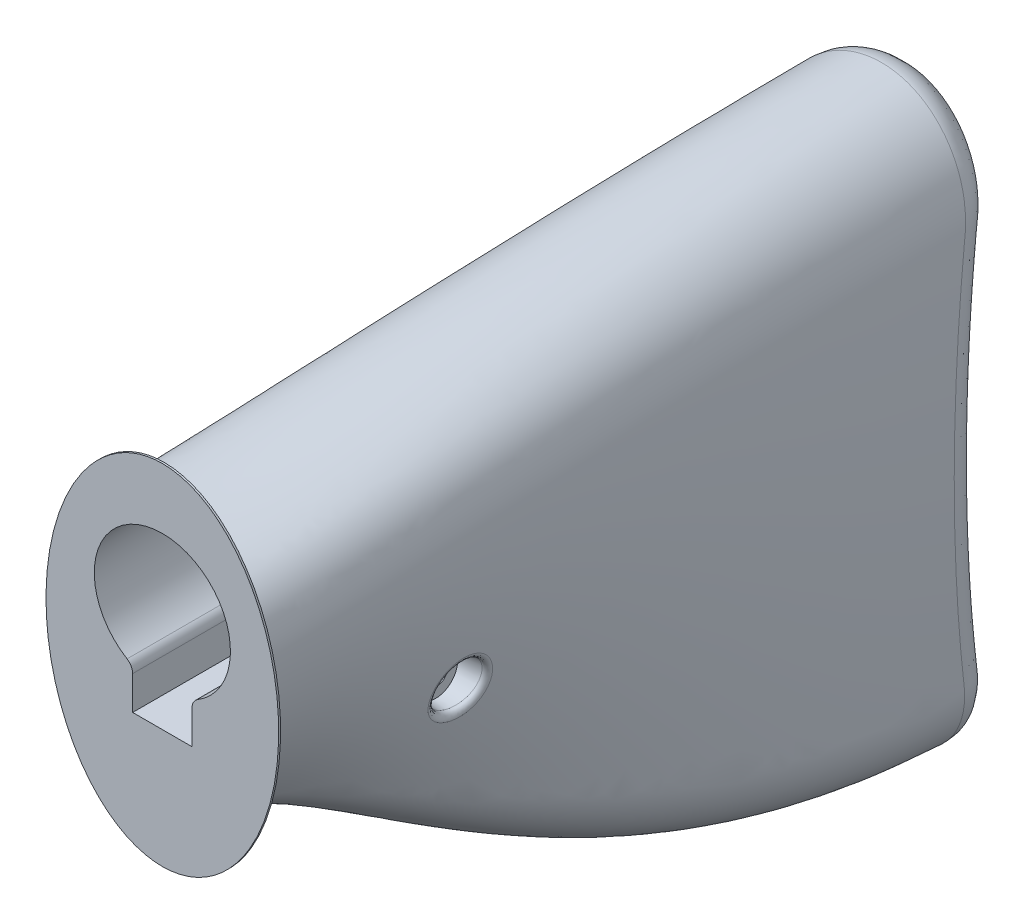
SolidWorks part; units mm, degrees
ref_plane "Front Plane" through (0, 0, 0) normal (0, 0, 1) x (1, 0, 0)
ref_plane "Top Plane" through (0, 0, 0) normal (0, 1, 0) x (1, 0, 0)
ref_plane "Right Plane" through (0, 0, 0) normal (1, 0, 0) x (0, 0, -1)
sketch "Sketch1" plane through (0, 0, 0) normal (0, 0, 1) x (1, 0, 0)
  line L0 (0, 37.2523) -> (0, -28.9777) construction
  line L1 (-22.225, 1.7278) -> (-22.225, 17.909) construction
  arc A0 (-14.2875, 13.501) -> (14.2875, 13.501) centre (0, -21.8186) cw
  arc A1 (-14.2875, 13.501) -> (-22.225, 1.7278) centre (-9.525, 1.7278) ccw
  arc A2 (14.2875, 13.501) -> (22.225, 1.7278) centre (9.525, 1.7278) cw
  arc A3 (-9.9123, -33.3395) -> (9.9123, -33.3395) centre (0, -25.4) ccw
  arc A4 (-22.225, 1.7278) -> (-9.9123, -33.3395) centre (33.8684, 1.7278) ccw
  arc A5 (22.225, 1.7278) -> (9.9123, -33.3395) centre (-33.8684, 1.7278) cw
  dimension "D1" = 12.7
  dimension "D2" = 38.1
  dimension "D3" = 25.4
  dimension "D4" = 44.45
  dimension "D5" = 21.8186
ref_plane "Plane1" through (0, 0, -165.1) normal (0, 0, -1) x (-1, 0, 0)
sketch "Sketch2" plane through (0, 0, -165.1) normal (0, 0, -1) x (-1, 0, 0)
  line L0 (0, 200037.2523) -> (0, -200028.9777) construction
  line L1 (0, 25.4) -> (0, -101.6) construction
  line L2 (-22.225, -38.1) -> (22.225, -38.1) construction
  line L3 (-20.9709, 5.5991) -> (-20.9709, -81.7991) construction
  arc A6 (20.9709, 5.5991) -> (14.2875, 19.7925) centre (0, 4.3945) ccw
  arc A7 (20.9709, -81.7991) -> (20.9709, 5.5991) centre (-739.775, -38.1) ccw
  arc A8 (-20.9709, -81.7991) -> (20.9709, -81.7991) centre (0, -80.5945) ccw
  arc A9 (-20.9709, 5.5991) -> (-20.9709, -81.7991) centre (739.775, -38.1) ccw
  arc A10 (-14.2875, 19.7925) -> (-20.9709, 5.5991) centre (0, 4.3945) ccw
  arc A11 (14.2875, 19.7925) -> (-14.2875, 19.7925) centre (0, 4.3945) ccw
  dimension "D1" = 25.4
  dimension "D2" = 762
  dimension "D4" = 127
  dimension "D5" = 44.45
loft "Loft1" add profiles "Sketch1", "Sketch2"
sketch "Sketch3" plane through (0, 0, 0) normal (0, 0, 1) x (1, 0, 0)
  line L0 (-6.477, -13.373) -> (-6.477, -22.225)
  line L1 (-6.477, -22.225) -> (6.477, -22.225)
  line L2 (6.477, -22.225) -> (6.477, -13.373)
  line L3 (0, -22.225) -> (0, 0) construction
  arc A0 (6.477, -13.373) -> (-6.477, -13.373) centre (0, 0) ccw
  point P11 (0, 14.859)
  dimension "D2" = 14.859
  dimension "D3" = 12.954
  dimension "D4" = 37.084
extrude "Cut-Extrude1" cut sketch "Sketch3" against normal blind 91.44
sketch "Sketch4" plane through (0, 0, 0) normal (1, 0, 0) x (0, 0, -1)
  line L1 (91.44, -22.225) -> (0, -22.225) construction
  circle A0 centre (45.72, -22.225) radius 25.4
  dimension "D1" = 50.8
extrude "Cut-Extrude2" cut sketch "Sketch4" against normal mid plane 2.54
sketch "Sketch5" plane through (0, 0, 0) normal (1, 0, 0) x (0, 0, -1)
  line L0 (91.44, -22.225) -> (0, -22.225) construction
  line L1 (47.763, -25.7177) -> (48.895, -27.0667)
  line L2 (48.895, -27.0667) -> (48.895, -27.7973)
  line L3 (48.895, -27.7973) -> (47.763, -29.1463)
  line L4 (45.72, -27.432) -> (48.895, -27.432) construction
  arc A0 (47.763, -25.7177) -> (47.763, -29.1463) centre (45.72, -27.432) ccw
  circle A1 centre (45.72, -27.432) radius 2.667 construction
  circle A2 centre (45.72, -22.225) radius 25.4
  circle A3 centre (45.72, -22.225) radius 25.4 construction
  point P2 (45.72, -24.765)
  point P13 (48.387, -27.432)
  dimension "D1" = 5.334
  dimension "D4" = 0.508
  dimension "D2" = 2.54
  dimension "D5" = 100
  dimension "D3" = 0
extrude "Cut-Extrude3" cut sketch "Sketch5" against normal through all both and the other way through all
ref_plane "Plane2" through (13.97, 0, 0) normal (1, 0, 0) x (0, 0, -1)
ref_plane "Plane3" through (-13.97, 0, 0) normal (-1, 0, 0) x (0, 0, 1)
sketch "Sketch6" plane through (13.97, 0, 0) normal (1, 0, 0) x (0, 0, -1)
  circle A0 centre (45.72, -27.432) radius 4.7625
  dimension "D1" = 9.525
extrude "Cut-Extrude4" cut sketch "Sketch6" along normal through all draft 5
sketch "Sketch7" plane through (-13.97, 0, 0) normal (-1, 0, 0) x (0, 0, 1)
  line L1 (-51.2926, -27.432) -> (-48.5063, -32.258)
  line L2 (-48.5063, -32.258) -> (-42.9337, -32.258)
  line L3 (-42.9337, -32.258) -> (-40.1474, -27.432)
  line L4 (-40.1474, -27.432) -> (-42.9337, -22.606)
  line L5 (-42.9337, -22.606) -> (-48.5063, -22.606)
  line L6 (-48.5063, -22.606) -> (-51.2926, -27.432)
  circle A0 centre (-45.72, -27.432) radius 4.826 construction
  dimension "D1" = 9.652
extrude "Cut-Extrude5" cut sketch "Sketch7" along normal through all draft 5
sketch "Sketch8" plane through (0, 0, 0) normal (1, 0, 0) x (0, 0, -1)
  line L0 (91.44, 14.859) -> (0, 14.859)
  line L1 (91.44, 14.859) -> (0, 14.859) construction
  line L2 (0, 0) -> (91.44, 0) construction
  line L3 (91.44, 14.859) -> (106.299, 0)
  line L4 (106.299, 0) -> (91.44, 0)
  line L5 (91.44, 14.859) -> (91.44, 0)
  dimension "D1" = 45
revolve "Cut-Revolve1" cut sketch "Sketch8" angle 360 about L2
sketch "Sketch9" plane through (0, -22.225, 0) normal (0, 1, 0) x (1, 0, 0)
  line L0 (-6.477, 91.44) -> (6.477, 91.44)
  line L1 (6.477, 91.44) -> (0, 97.917)
  line L2 (0, 97.917) -> (-6.477, 91.44)
  dimension "D1" = 90
extrude "Cut-Extrude6" cut sketch "Sketch9" along normal up to next
fillet "Fillet1" radius 1.27 7 edges at (19.3271, -26.1032, -40.6604)
fillet "Fillet2" radius 1.27 2 edges at (1.27, -47.625, -45.72) (-1.27, -47.625, -45.72)
fillet "Fillet3" radius 1.27 6 edges at (0.898, -22.225, -70.748) (0.898, -22.225, -20.692) (-0.898, -22.225, -70.748) (-0.898, -22.225, -20.692) (-1.27, -22.225, -45.72) (1.27, -22.225, -45.72)
fillet "Fillet4" radius 2.54 3 edges at (6.477, -17.799, -91.44) (0, 14.859, -91.44) (-6.477, -17.799, -91.44)
fillet "Fillet5" radius 2.54 6 edges at (-6.477, -13.373, -45.1939) (-6.1935, -13.1942, -91.554) (6.1935, -13.1942, -91.554) (6.477, -13.373, -45.1939)
sketch "Sketch14" plane through (0, 0, 0) normal (1, 0, 0) x (0, 0, -1)
  circle A0 centre (411.0342, -38.1002) radius 254
  dimension "D1" = 508
extrude "Cut-Extrude7" cut sketch "Sketch14" against normal through all both and the other way through all
fillet "Fillet6" radius 6.35 1 edges at (-21.0017, -81.0487, -160.6916)
sketch "Sketch13" plane through (0, 0, 0) normal (0, 0, 1) x (1, 0, 0)
  line L4 (-6.477, -13.373) -> (-6.477, -22.225)
  line L5 (-6.477, -22.225) -> (6.477, -22.225)
  line L6 (6.477, -22.225) -> (6.477, -13.373)
  line L7 (-6.477, -14.8802) -> (-6.477, -22.225)
  line L8 (-6.477, -22.225) -> (6.477, -22.225)
  line L9 (6.477, -22.225) -> (6.477, -14.8802)
  arc A0 (6.477, -14.8802) -> (7.7006, -12.7079) centre (9.017, -14.8802) cw
  arc A1 (6.477, -13.373) -> (-6.477, -13.373) centre (0, 0) ccw
  arc A2 (7.7006, -12.7079) -> (-7.7006, -12.7079) centre (0, 0) ccw
  arc A3 (-6.477, -14.8802) -> (-7.7006, -12.7079) centre (-9.017, -14.8802) ccw
  ellipse E0 centre (0, -10.0183) end of major axis (0, -48.1183) minor radius 25.4
  dimension "D2" = 2.54
  dimension "D3" = 76.2
  dimension "D4" = 50.8
  dimension "D1" = 0
extrude "Boss-Extrude2" add sketch "Sketch13" against normal blind 0.4064
